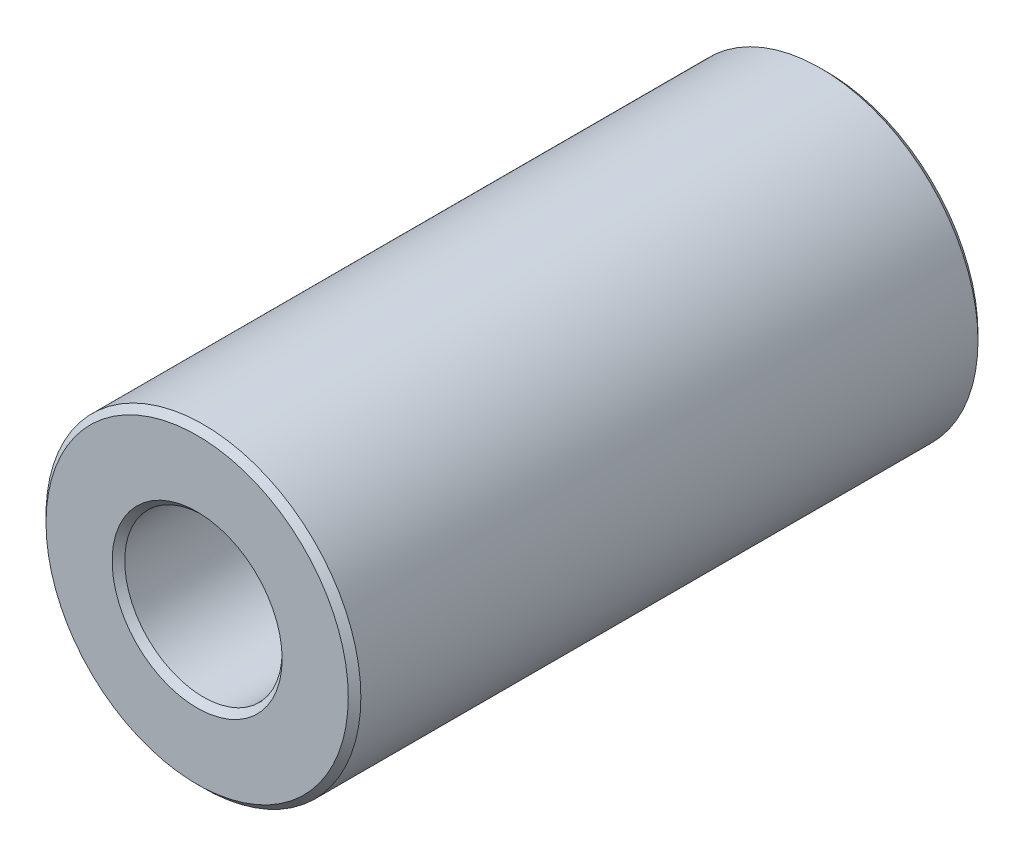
SolidWorks part; units mm, degrees
ref_plane "Front Plane" through (0, 0, 0) normal (0, 0, 1) x (1, 0, 0)
ref_plane "Top Plane" through (0, 0, 0) normal (0, 1, 0) x (1, 0, 0)
ref_plane "Right Plane" through (0, 0, 0) normal (1, 0, 0) x (0, 0, -1)
sketch "Sketch1" plane through (0, 0, 0) normal (0, 0, 1) x (1, 0, 0)
  circle A0 centre (0, 0) radius 2.5
  circle A1 centre (0, 0) radius 1.25
  dimension "D1" = 5
  dimension "D2" = 2.5
extrude "Boss-Extrude2" add sketch "Sketch1" along normal mid plane 10
chamfer "Chamfer3" distance 0.1 angle 45 4 edges at (2.5, 0, 5) (2.5, 0, -5) (1.25, 0, -5) (1.25, 0, 5)
